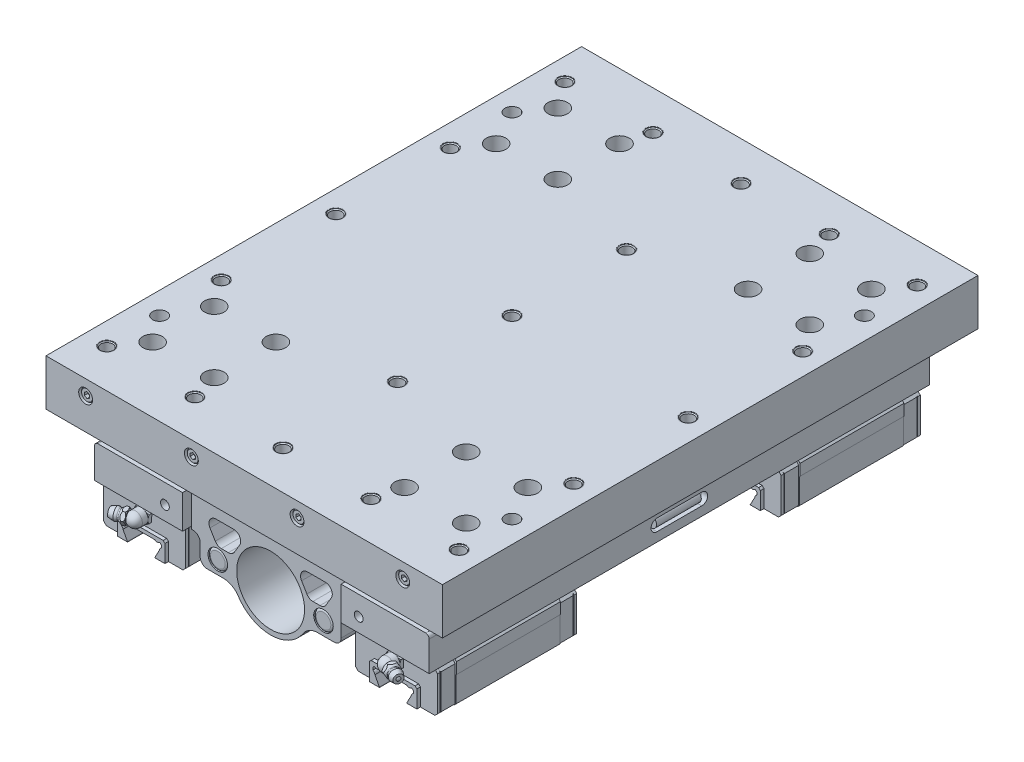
SolidWorks part; units mm, degrees
ref_plane "Front" through (0, 0, 0) normal (0, 0, 1) x (1, 0, 0)
ref_plane "Top" through (0, 0, 0) normal (0, 1, 0) x (1, 0, 0)
ref_plane "Right" through (0, 0, 0) normal (1, 0, 0) x (0, 0, -1)
imported_body "Imported1"
imported_body "Imported2"
imported_body "Imported3"
sketch "Sketch1" plane through (0, 0, -90) normal (0, 0, 1) x (1, 0, 0)
  line L1 (19.05, -19.05) -> (19.05, 19.05)
  line L2 (19.05, 19.05) -> (-19.05, 19.05)
  line L3 (-19.05, 19.05) -> (-19.05, -19.05)
  line L4 (-19.05, -19.05) -> (19.05, -19.05)
  circle A0 centre (0, 0) radius 19.05 construction
  circle A1 centre (0, 0) radius 12.7
  dimension "D1" = 38.1
  dimension "D2" = 25.4
extrude "Boss-Extrude1" add sketch "Sketch1" along normal blind 60.96
